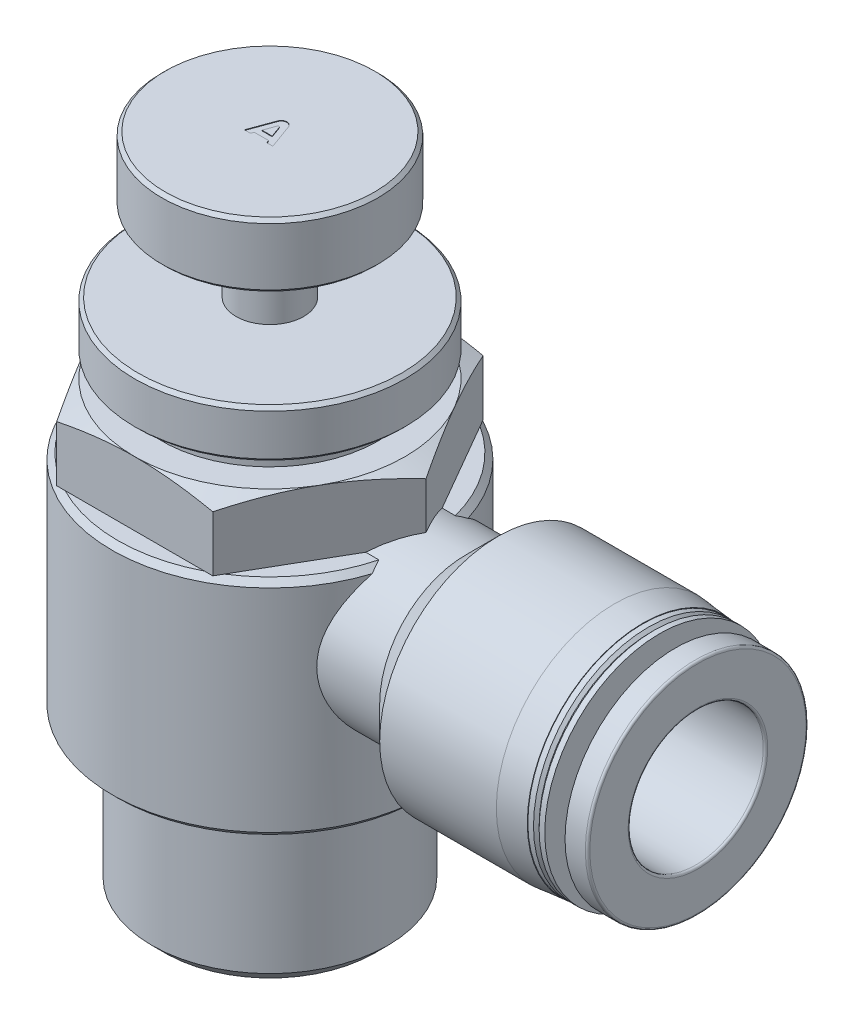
SolidWorks part; units mm, degrees
ref_plane "前视基准面" through (0, 0, 0) normal (0, 0, 1) x (1, 0, 0)
ref_plane "上视基准面" through (0, 0, 0) normal (0, 1, 0) x (1, 0, 0)
ref_plane "右视基准面" through (0, 0, 0) normal (1, 0, 0) x (0, 0, -1)
sketch "草图1" plane through (0, 0, 0) normal (0, 0, 1) x (1, 0, 0)
  line L0 (0, -27) -> (-9.3155, -27)
  line L1 (-9.3155, -27) -> (-10.4775, -25.838)
  line L2 (-10.4775, -25.838) -> (-10.4775, -13)
  line L3 (-10.4775, -13) -> (-13.5, -13)
  line L4 (-13.5, -13) -> (-14, -12.5)
  line L5 (-14, -12.5) -> (-14, 6.3)
  line L6 (-14, 6.3) -> (-13.5, 6.8)
  line L7 (-13.5, 6.8) -> (-13.8564, 6.8)
  line L8 (-13.8564, 6.8) -> (-13.8564, 11.7311)
  line L9 (-13.8564, 11.7311) -> (-12, 12.5)
  line L10 (-12, 12.5) -> (-9.6, 12.5)
  line L11 (-9.6, 12.5) -> (-9.6, 13.7)
  line L12 (-9.6, 13.7) -> (-9.3, 14)
  line L13 (-9.3, 14) -> (-3, 14)
  line L14 (-3, 14) -> (-3, 14.5)
  line L15 (-3, 14.5) -> (-11.7, 14.5)
  line L16 (-11.7, 14.5) -> (-12, 14.8)
  line L17 (-12, 14.8) -> (-12, 18.475)
  line L18 (-12, 18.475) -> (-11.7, 18.775)
  line L19 (-11.7, 18.775) -> (-3, 18.775)
  line L20 (-3, 18.775) -> (-3, 25.4935)
  line L21 (-3, 25.4935) -> (-2.6935, 25.8)
  line L22 (-2.6935, 25.8) -> (-9.3, 25.8)
  line L23 (-9.3, 25.8) -> (-9.6, 26.1)
  line L24 (-9.6, 26.1) -> (-9.6, 31.2)
  line L25 (-9.6, 31.2) -> (-9.3, 31.5)
  line L26 (-9.3, 31.5) -> (0, 31.5)
  line L27 (0, 31.5) -> (0, -27)
  line L28 (0, 31.5) -> (0, -27) construction
revolve "旋转1" add sketch "草图1" angle 360 about L28
ref_plane "基准面1" through (0, 6.8, 0) normal (0, 1, 0) x (1, 0, 0)
sketch "草图2" plane through (0, 6.8, 0) normal (0, 1, 0) x (1, 0, 0)
  line L0 (-13.8564, 0) -> (-6.9282, -12)
  line L1 (-6.9282, -12) -> (6.9282, -12)
  line L2 (6.9282, -12) -> (13.8564, 0)
  line L3 (13.8564, 0) -> (6.9282, 12)
  line L4 (6.9282, 12) -> (-6.9282, 12)
  line L5 (-6.9282, 12) -> (-13.8564, 0)
  circle A0 centre (0, 0) radius 24
extrude "切除-拉伸1" cut sketch "草图2" along normal blind 5.7
sketch "草图3" plane through (0, 0, 0) normal (0, 0, 1) x (1, 0, 0)
  line L0 (0, 4) -> (15, 4)
  line L1 (15, 4) -> (15, 6)
  line L2 (15, 6) -> (37.8, 6)
  line L3 (38, 6.2) -> (38, 9.6)
  line L4 (37.8, 9.8) -> (36, 9.8)
  line L5 (36, 9.8) -> (36, 6.9)
  line L6 (36, 6.9) -> (34.6, 6.9)
  line L7 (34.6, 6.9) -> (34.6, 10.2)
  line L8 (34.6, 10.2) -> (34.1, 10.2)
  line L9 (34.1, 10.2) -> (33.85, 9.95)
  line L10 (33.85, 9.95) -> (33.6, 10.2)
  line L11 (33.6, 10.2) -> (33.1, 10.2)
  line L12 (33.1, 10.2) -> (33.1, 10.25)
  line L13 (33.1, 10.25) -> (30.6, 10.5)
  line L14 (30.6, 10.5) -> (20.2464, 10.5)
  line L15 (20.2464, 10.5) -> (17.3464, 7.6)
  line L16 (17.3464, 7.6) -> (0, 7.6)
  line L17 (0, 7.6) -> (0, 4)
  line L18 (38, 0) -> (0, 0) construction
  arc A0 (37.8, 6) -> (38, 6.2) centre (37.8, 6.2) ccw
  arc A1 (38, 9.6) -> (37.8, 9.8) centre (37.8, 9.6) ccw
revolve "旋转2" add sketch "草图3" angle 360 about L18
sketch "草图4" plane through (0, 0, 0) normal (0, 0, 1) x (1, 0, 0)
  line L0 (0, -27) -> (-5.5387, -27)
  line L1 (-5.2387, -26.7) -> (-5.2387, 0)
  line L2 (-5.2387, 0) -> (-3.4925, 0)
  line L3 (-3.4925, 0) -> (-3.4925, 3.4925)
  line L4 (0, 6.985) -> (0, -27)
  line L5 (0, 6.985) -> (0, -27) construction
  arc A0 (-5.5387, -27) -> (-5.2387, -26.7) centre (-5.5387, -26.7) ccw
  arc A1 (-3.4925, 3.4925) -> (0, 6.985) centre (0, 3.4925) cw
revolve "切除-旋转1" cut sketch "草图4" angle 360 about L5
sketch "草图5" plane through (0, 0, 0) normal (0, 0, 1) x (1, 0, 0)
  line L0 (0, 0) -> (0, 4)
  line L1 (0, 4) -> (15, 4)
  line L2 (15, 4) -> (15, 6)
  line L3 (15, 6) -> (38, 6)
  line L4 (38, 6) -> (38, 0)
  line L5 (38, 0) -> (0, 0)
  line L6 (38, 0) -> (0, 0) construction
revolve "切除-旋转2" cut sketch "草图5" angle 360 about L6
ref_plane "基准面2" through (0, 31.5, 0) normal (0, 1, 0) x (1, 0, 0)
sketch "草图6" plane through (0, 31.5, 0) normal (0, 1, 0) x (1, 0, 0)
  line L0 (-1.26, -1) -> (-0.7279, -1)
  line L1 (-0.7279, -1) -> (-0.6369, -0.75)
  line L2 (-0.6369, -0.75) -> (0.6369, -0.75)
  line L3 (0.6369, -0.75) -> (0.7279, -1)
  line L4 (0.7279, -1) -> (1.26, -1)
  line L5 (1.26, -1) -> (0.4698, 1.171)
  line L6 (-0.4698, 1.171) -> (-1.26, -1)
  line L7 (-0.455, -0.25) -> (0.455, -0.25)
  line L8 (0.455, -0.25) -> (0.094, 0.7418)
  line L9 (-0.094, 0.7418) -> (-0.455, -0.25)
  arc A0 (0.4698, 1.171) -> (-0.4698, 1.171) centre (0, 1) ccw
  arc A1 (0.094, 0.7418) -> (-0.094, 0.7418) centre (0, 0.7076) ccw
extrude "切除-拉伸2" cut sketch "草图6" against normal blind 0.05
